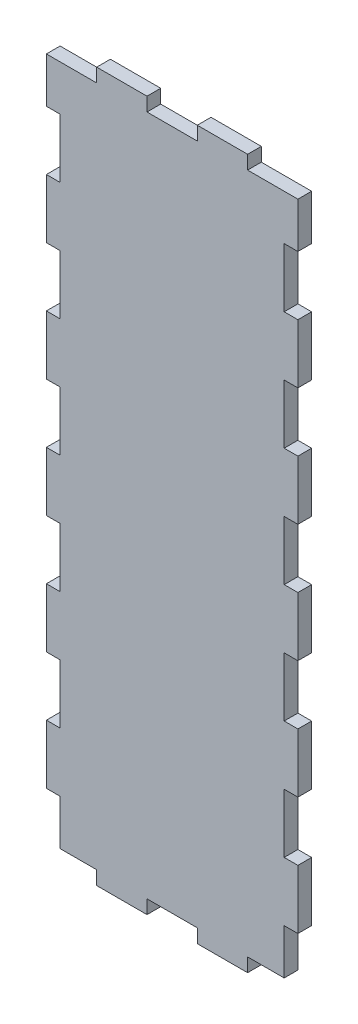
SolidWorks part; units mm, degrees
ref_plane "Front Plane" through (0, 0, 0) normal (0, 0, 1) x (1, 0, 0)
ref_plane "Top Plane" through (0, 0, 0) normal (0, 1, 0) x (1, 0, 0)
ref_plane "Right Plane" through (0, 0, 0) normal (1, 0, 0) x (0, 0, -1)
sketch "Sketch1" plane through (0, 0, 0) normal (0, 0, 1) x (1, 0, 0)
  line L1 (-27.5, 77.5) -> (27.5, 77.5)
  line L2 (-27.5, 77.5) -> (-27.5, -77.5)
  line L3 (-27.5, -77.5) -> (27.5, -77.5)
  line L4 (27.5, 77.5) -> (27.5, -77.5)
  line L5 (-27.5, 77.5) -> (27.5, -77.5) construction
  line L6 (-27.5, -77.5) -> (27.5, 77.5) construction
  point P0 (0, 0)
extrude "Boss-Extrude1" add sketch "Sketch1" along normal blind 3
sketch "Sketch2" plane through (0, 0, 3) normal (0, 0, 1) x (1, 0, 0)
  line L0 (-27.5, 77.5) -> (-27.5, 64.5833)
  line L1 (-27.5, 77.5) -> (-27.5, -77.5) construction
  line L2 (-27.5, 64.5833) -> (-24.5, 64.5833)
  line L3 (-24.5, 64.5833) -> (-24.5, 51.6667)
  line L4 (-24.5, 51.6667) -> (-27.5, 51.6667)
  line L5 (-27.5, 51.6667) -> (-27.5, 38.75)
  line L6 (-27.5, 38.75) -> (-24.5, 38.75)
  line L7 (-24.5, 38.75) -> (-24.5, 25.8333)
  line L8 (-24.5, 25.8333) -> (-27.5, 25.8333)
  line L9 (-27.5, 25.8333) -> (-27.5, 12.9167)
  line L10 (-27.5, 12.9167) -> (-24.5, 12.9167)
  line L11 (-24.5, 12.9167) -> (-24.5, 0)
  line L12 (-24.5, 0) -> (-27.5, 0)
  line L13 (-27.5, 0) -> (-27.5, -12.9167)
  line L14 (-27.5, -12.9167) -> (-24.5, -12.9167)
  line L15 (-24.5, -12.9167) -> (-24.5, -25.8333)
  line L16 (-24.5, -25.8333) -> (-27.5, -25.8333)
  line L17 (-27.5, -25.8333) -> (-27.5, -38.75)
  line L18 (-27.5, -38.75) -> (-24.5, -38.75)
  line L19 (-24.5, -38.75) -> (-24.5, -51.6667)
  line L20 (-24.5, -51.6667) -> (-27.5, -51.6667)
  line L21 (-27.5, -51.6667) -> (-27.5, -64.5833)
  line L22 (-27.5, -64.5833) -> (-24.5, -64.5833)
  line L23 (-24.5, -64.5833) -> (-24.5, -77.5)
  line L24 (-27.5, -77.5) -> (27.5, -77.5) construction
  line L25 (-27.5, 64.5833) -> (-27.5, -64.5833)
  line L26 (0, 77.5) -> (0, -77.5) construction
  line L27 (27.5, 77.5) -> (-27.5, 77.5) construction
  line L28 (24.5, -64.5833) -> (24.5, -77.5)
  line L29 (27.5, -64.5833) -> (24.5, -64.5833)
  line L30 (27.5, -51.6667) -> (27.5, -64.5833)
  line L31 (24.5, -51.6667) -> (27.5, -51.6667)
  line L32 (24.5, -38.75) -> (24.5, -51.6667)
  line L33 (27.5, -38.75) -> (24.5, -38.75)
  line L34 (27.5, -25.8333) -> (27.5, -38.75)
  line L35 (24.5, -25.8333) -> (27.5, -25.8333)
  line L36 (24.5, -12.9167) -> (24.5, -25.8333)
  line L37 (27.5, -12.9167) -> (24.5, -12.9167)
  line L38 (27.5, 0) -> (27.5, -12.9167)
  line L39 (24.5, 0) -> (27.5, 0)
  line L40 (24.5, 12.9167) -> (24.5, 0)
  line L41 (27.5, 12.9167) -> (24.5, 12.9167)
  line L42 (27.5, 25.8333) -> (27.5, 12.9167)
  line L43 (24.5, 25.8333) -> (27.5, 25.8333)
  line L44 (24.5, 38.75) -> (24.5, 25.8333)
  line L45 (27.5, 38.75) -> (24.5, 38.75)
  line L46 (27.5, 51.6667) -> (27.5, 38.75)
  line L47 (24.5, 51.6667) -> (27.5, 51.6667)
  line L48 (24.5, 64.5833) -> (24.5, 51.6667)
  line L49 (27.5, 64.5833) -> (24.5, 64.5833)
  line L50 (27.5, 77.5) -> (27.5, 64.5833)
  line L51 (-24.5, -77.5) -> (-27.5, -77.5)
  line L52 (-27.5, -77.5) -> (-27.5, 64.5833)
  line L53 (24.5, -77.5) -> (27.5, -77.5)
  line L54 (27.5, -77.5) -> (27.5, 64.5833)
extrude "Cut-Extrude1" cut sketch "Sketch2" against normal blind 3 contours L4 L3 L2 M27 | L8 L7 L6 M27 | L12 L11 L10 M27 | L16 L15 L14 M27 | L20 L19 L18 M27 | L23 L22 M27 M28 | L29 L28 M25 M28 | L33 L32 L31 M25 | L37 L36 L35 M25 | L41 L40 L39 M25 | L45 L44 L43 M25 | L49 L48 L47 M25
sketch "Sketch3" plane through (0, 0, 3) normal (0, 0, 1) x (1, 0, 0)
  line L0 (-27.5, 77.5) -> (-27.5, 74.5)
  line L1 (-27.5, 77.5) -> (-27.5, 64.5833) construction
  line L2 (-27.5, 74.5) -> (-16.5, 74.5)
  line L3 (-16.5, 74.5) -> (-16.5, 77.5)
  line L4 (27.5, 77.5) -> (-27.5, 77.5) construction
  line L5 (-16.5, 77.5) -> (-5.5, 77.5)
  line L6 (-5.5, 77.5) -> (-5.5, 74.5)
  line L7 (-5.5, 74.5) -> (5.5, 74.5)
  line L8 (5.5, 74.5) -> (5.5, 77.5)
  line L9 (5.5, 77.5) -> (16.5, 77.5)
  line L10 (16.5, 77.5) -> (16.5, 74.5)
  line L11 (16.5, 74.5) -> (27.5, 74.5)
  line L12 (27.5, 74.5) -> (27.5, 77.5)
  line L13 (-27.5, 0) -> (27.5, 0) construction
  line L14 (-27.5, 0) -> (-27.5, -12.9167) construction
  line L15 (27.5, -12.9167) -> (27.5, 0) construction
  line L16 (27.5, -74.5) -> (27.5, -77.5)
  line L17 (16.5, -74.5) -> (27.5, -74.5)
  line L18 (16.5, -77.5) -> (16.5, -74.5)
  line L19 (5.5, -77.5) -> (16.5, -77.5)
  line L20 (5.5, -74.5) -> (5.5, -77.5)
  line L21 (-5.5, -74.5) -> (5.5, -74.5)
  line L22 (-5.5, -77.5) -> (-5.5, -74.5)
  line L23 (-16.5, -77.5) -> (-5.5, -77.5)
  line L24 (-16.5, -74.5) -> (-16.5, -77.5)
  line L25 (-27.5, -74.5) -> (-16.5, -74.5)
  line L26 (-27.5, -77.5) -> (-27.5, -74.5)
  line L27 (27.5, 77.5) -> (-27.5, 77.5)
  line L28 (27.5, -77.5) -> (-27.5, -77.5)
  line L29 (-27.5, -77.5) -> (-27.4659, -77.7621)
extrude "Cut-Extrude2" cut sketch "Sketch3" against normal blind 3 contours L2 L3 M57 M58 | L10 L11 M56 M57 | L7 L8 L6 M57 | L18 L17 M33 M34 | L22 L20 L21 M33 | L25 L24 M32 M33
equation "\"Thickness of material\"= 3mm"
equation "\"Length of box\"= 155mm"
equation "\"width of box\"= 55mm"
equation "\"D2@Sketch1\"=\"Length of box\""
equation "\"D1@Boss-Extrude1\"=\"Thickness of material\""
equation "\"D1@Sketch2\"=\"Length of box\"/12"
equation "\"D2@Sketch2\"=\"Length of box\"/12"
equation "\"D4@Sketch2\"=\"Length of box\"/12"
equation "\"D5@Sketch2\"=\"Length of box\"/12"
equation "\"D6@Sketch2\"=\"Length of box\"/12"
equation "\"D7@Sketch2\"=\"Length of box\"/12"
equation "\"D8@Sketch2\"=\"Length of box\"/12"
equation "\"D9@Sketch2\"=\"Length of box\"/12"
equation "\"D10@Sketch2\"=\"Length of box\"/12"
equation "\"D11@Sketch2\"=\"Length of box\"/12"
equation "\"D12@Sketch2\"=\"Thickness of material\""
equation "\"D13@Sketch2\"=\"Thickness of material\""
equation "\"D14@Sketch2\"=\"Thickness of material\""
equation "\"D15@Sketch2\"=\"Thickness of material\""
equation "\"D16@Sketch2\"=\"Thickness of material\""
equation "\"D17@Sketch2\"=\"Thickness of material\""
equation "\"D1@Sketch1\"=\"width of box\""
equation "\"D5@Sketch3\"=\"width of box\"/5"
equation "\"D3@Sketch3\"=\"width of box\"/5"
equation "\"D4@Sketch3\"=\"Thickness of material\""
equation "\"D6@Sketch3\"=\"Thickness of material\""
equation "\"D1@Sketch3\"=\"Thickness of material\""
equation "\"D2@Sketch3\"=\"width of box\"/5"
equation "\"D7@Sketch3\"=\"width of box\"/5"
equation "\"D1@Cut-Extrude2\"=\"Thickness of material\""
equation "\"D3@Sketch2\"=\"Length of box\"/12"
